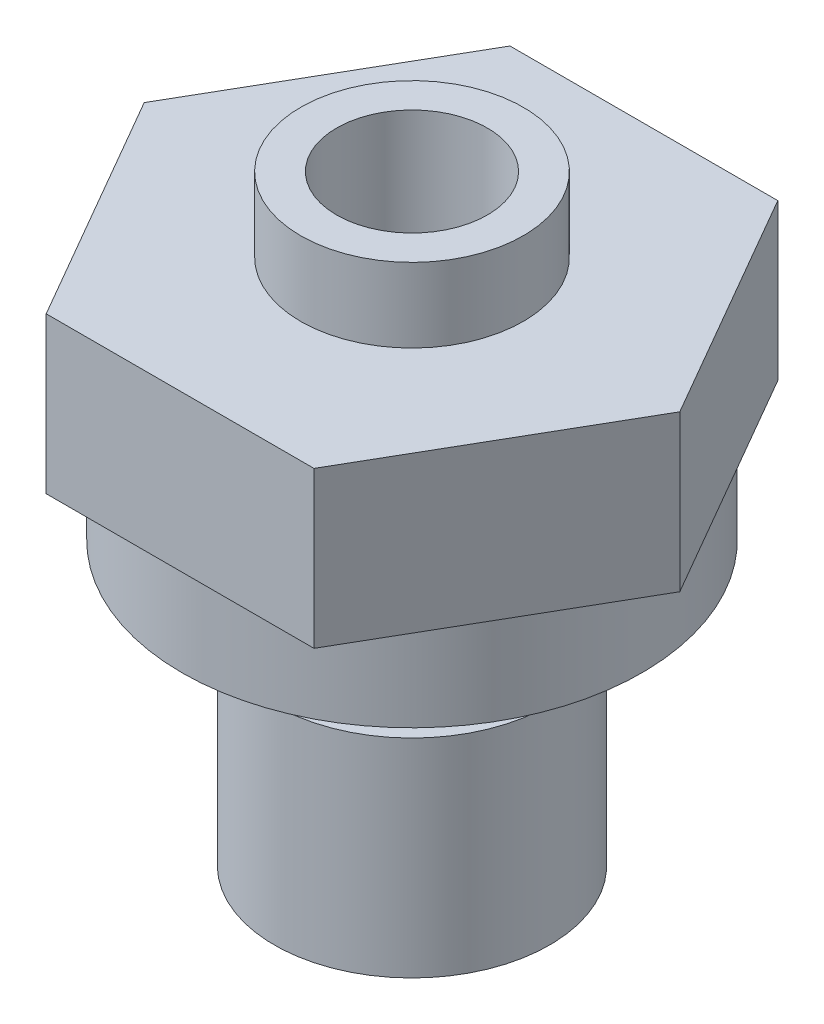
SolidWorks part; units mm, degrees
ref_plane "Front Plane" through (0, 0, 0) normal (0, 0, 1) x (1, 0, 0)
ref_plane "Top Plane" through (0, 0, 0) normal (0, 1, 0) x (1, 0, 0)
ref_plane "Right Plane" through (0, 0, 0) normal (1, 0, 0) x (0, 0, -1)
sketch "Sketch1" plane through (0, 0, 0) normal (0, 1, 0) x (1, 0, 0)
  line L3 (0, 7.9375) -> (4.5827, 7.9375)
  line L4 (0, 7.9375) -> (-4.5827, 7.9375)
  line L5 (-6.8741, 3.9687) -> (-9.1654, 0)
  line L6 (6.8741, 3.9687) -> (9.1654, 0)
  line L7 (-6.8741, 3.9687) -> (-4.5827, 7.9375)
  line L8 (6.8741, 3.9687) -> (4.5827, 7.9375)
  line L9 (0, 0) -> (9.1654, 0) construction
  line L10 (6.8741, -3.9687) -> (4.5827, -7.9375)
  line L11 (-6.8741, -3.9687) -> (-4.5827, -7.9375)
  line L12 (6.8741, -3.9687) -> (9.1654, 0)
  line L13 (-6.8741, -3.9687) -> (-9.1654, 0)
  line L14 (0, -7.9375) -> (-4.5827, -7.9375)
  line L15 (0, -7.9375) -> (4.5827, -7.9375)
extrude "Extrude1" add sketch "Sketch1" along normal blind 5.334
sketch "Sketch2" plane through (0, 0, 0) normal (0, -1, 0) x (1, 0, 0)
  circle A0 centre (0, 0) radius 7.874
extrude "Extrude2" add sketch "Sketch2" along normal blind 3.048
sketch "Sketch3" plane through (0, -3.048, 0) normal (0, -1, 0) x (1, 0, 0)
  circle A0 centre (0, 0) radius 6.985
  circle A1 centre (0, 0) radius 4.826
extrude "Cut-Extrude1" cut sketch "Sketch3" against normal blind 1.27
sketch "Sketch4" plane through (0, -3.048, 0) normal (0, -1, 0) x (1, 0, 0)
  circle A0 centre (0, 0) radius 3.9751
extrude "Extrude3" add sketch "Sketch4" along normal blind 2.54
sketch "Sketch5" plane through (0, -5.588, 0) normal (0, -1, 0) x (1, 0, 0)
  circle A0 centre (0, 0) radius 4.7117
extrude "Extrude4" add sketch "Sketch5" along normal blind 7.112
sketch "Sketch7" plane through (0, 5.334, 0) normal (0, 1, 0) x (-1, 0, 0)
  circle A0 centre (0, 0) radius 3.81
extrude "Extrude5" add sketch "Sketch7" along normal blind 2.54
sketch "Sketch8" plane through (0, 7.874, 0) normal (0, 1, 0) x (-1, 0, 0)
  circle A0 centre (0, 0) radius 1.524
extrude "Cut-Extrude2" cut sketch "Sketch8" against normal through all
sketch "Sketch9" plane through (0, 7.874, 0) normal (0, 1, 0) x (-1, 0, 0)
  circle A0 centre (0, 0) radius 2.5806
extrude "Cut-Extrude3" cut sketch "Sketch9" against normal blind 3.81
chamfer "Chamfer1" distance 0.508 distance2 1.016 1 edges at (0, 4.064, 1.524)
chamfer "Chamfer2" distance 4.064 angle 30 1 edges at (0, -12.7, 1.524)
